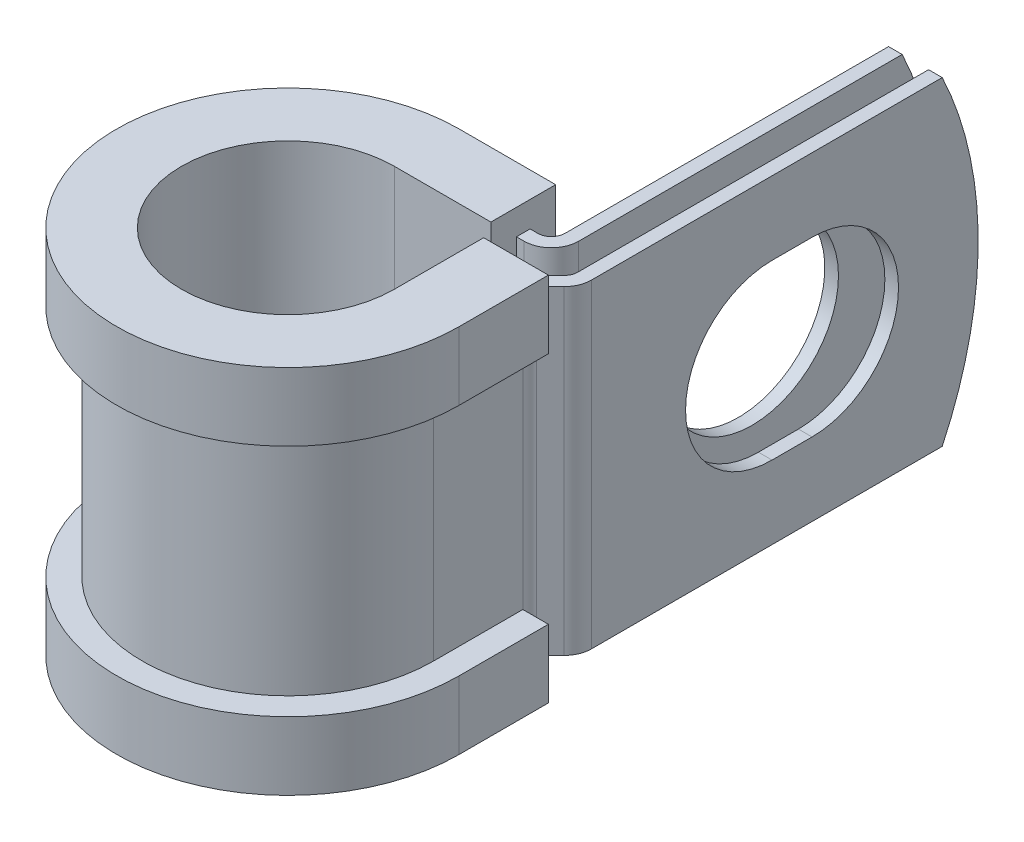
SolidWorks part; units mm, degrees
ref_plane "Front Plane" through (0, 0, 0) normal (0, 0, 1) x (1, 0, 0)
ref_plane "Top Plane" through (0, 0, 0) normal (0, 1, 0) x (1, 0, 0)
ref_plane "Right Plane" through (0, 0, 0) normal (1, 0, 0) x (0, 0, -1)
sketch "Sketch1" plane through (0, 0, 0) normal (0, 1, 0) x (1, 0, 0)
  line L0 (0, 7.874) -> (6.214, 7.874)
  line L1 (7.874, 0) -> (7.874, 5.3236)
  line L2 (7.8396, 30.9372) -> (7.8396, 9.4996)
  line L3 (8.3501, 6.4731) -> (9.1763, 7.2993)
  line L5 (9.4144, 7.874) -> (9.4144, 30.9372)
  arc A0 (0, 7.874) -> (7.874, 0) centre (0, 0) ccw
  arc A1 (8.3501, 6.4731) -> (7.874, 5.3236) centre (9.4996, 5.3236) ccw
  arc A2 (9.1763, 7.2993) -> (9.4144, 7.874) centre (8.6016, 7.874) ccw
  arc A3 (6.214, 7.874) -> (7.8396, 9.4996) centre (6.214, 9.4996) ccw
extrude "Extrude-Thin1" add sketch "Sketch1" along normal mid plane 19.05 thin
sketch "Sketch2" plane through (7.0268, 0, 0) normal (-1, 0, 0) x (0, 0, 1)
  line L0 (-30.9372, 9.525) -> (-30.9372, -9.525) construction
  line L1 (0, 9.525) -> (0, -9.525) construction
  circle A0 centre (-19.8374, 0) radius 5.1562
  point P2 (-30.9372, 0)
extrude "Cut-Extrude1" cut sketch "Sketch2" against normal up to surface (0.8128 mm away)
sketch "Sketch3" plane through (10.2272, 0, 0) normal (1, 0, 0) x (0, 0, -1)
  line L0 (18.6436, 0) -> (21.0312, 0) construction
  line L1 (18.6436, 5.1562) -> (21.0312, 5.1562)
  line L2 (18.6436, -5.1562) -> (21.0312, -5.1562)
  line L3 (30.9372, 9.525) -> (30.9372, -9.525) construction
  arc A0 (18.6436, 5.1562) -> (18.6436, -5.1562) centre (18.6436, 0) ccw
  arc A1 (21.0312, -5.1562) -> (21.0312, 5.1562) centre (21.0312, 0) ccw
  point P3 (19.8374, 0)
  point P8 (30.9372, 0)
  point P11 (13.4874, 0)
  point P12 (26.1874, 0)
extrude "Cut-Extrude2" cut sketch "Sketch3" against normal up to surface (0.8128 mm away)
sketch "Sketch4" plane through (7.0268, 0, 0) normal (-1, 0, 0) x (0, 0, 1)
  line L0 (-30.9372, 9.525) -> (-30.9372, -9.525)
  line L1 (-30.9372, 9.525) -> (-28.7927, 9.525)
  line L2 (-30.9372, 9.525) -> (-9.4996, 9.525) construction
  line L3 (-30.9372, -9.525) -> (-28.7927, -9.525)
  line L4 (-30.9372, -9.525) -> (-9.4996, -9.525) construction
  arc A0 (-28.7927, 9.525) -> (-28.7927, -9.525) centre (-8.7122, 0) ccw
extrude "Cut-Extrude3" cut sketch "Sketch4" against normal through all contours A0 M4 M5 | A0 L0 M2
ref_plane "Plane1" through (0, 0, -5.3236) normal (0, 0, -1) x (-1, 0, 0)
ref_plane "Plane2" through (5.7568, 0, 0) normal (-1, 0, 0) x (0, 0, 1)
sketch "Sketch5" plane through (0, 0, -5.3236) normal (0, 0, -1) x (-1, 0, 0)
  line L0 (-8.6868, 9.525) -> (-7.874, 9.525)
  line L1 (-8.6868, 9.525) -> (-8.6868, -9.525) construction
  line L3 (-7.874, 9.525) -> (-7.874, -9.525)
  line L4 (-7.874, -9.525) -> (-8.6868, -9.525)
  line L5 (-8.6868, -9.525) -> (-8.6868, -6.985)
  line L6 (-8.6868, 9.525) -> (-8.6868, 6.985)
  line L7 (-10.2108, 11.049) -> (-10.2108, 6.985)
  line L8 (-10.2108, 11.049) -> (-6.35, 11.049)
  line L9 (-6.35, 11.049) -> (-6.35, -11.049)
  line L10 (-6.35, -11.049) -> (-10.2108, -11.049)
  line L11 (-10.2108, -11.049) -> (-10.2108, -6.985)
  line L12 (-10.2108, 6.985) -> (-8.6868, 6.985)
  line L13 (-8.6868, -6.985) -> (-10.2108, -6.985)
sketch "Sketch6" plane through (0, 9.525, 0) normal (0, 1, 0) x (1, 0, 0)
  line L0 (6.35, 0) -> (6.35, 5.3236)
  line L1 (6.35, 5.3236) -> (10.2108, 5.3236) construction
  line L2 (5.7568, 6.9878) -> (5.7568, -6.9878) construction
  line L5 (0, 6.35) -> (5.7568, 6.35)
  arc A0 (0, 6.35) -> (6.35, 0) centre (0, 0) ccw
sweep "Sweep1" add profiles "Sketch5" path "Sketch6"
equation "\"D4@Sketch5\" = \"D1@Extrude-Thin1\""
equation "\"D5@Sketch5\" = \"D5@Extrude-Thin1\""
equation "\"D1@Sketch3\" = \"D2@Sketch2\""
equation "\"D7@Sketch1\" = \"D3@Sketch2\" + \"D1@Sketch3\""
equation "\"D1@Sketch1\" = \"D1@Sketch6\" + 2 * \"D3@Sketch5\""
equation "\"D1@Sketch4\" = ( \"D1@Extrude-Thin1\" + .125 ) * 2"
equation "\"D9@Sketch1\"= \"D5@Extrude-Thin1\""
equation "\"D8@Sketch1\"= 2 * \"D5@Extrude-Thin1\""
equation "\"D2@Sketch1\" = 2 * \"D5@Extrude-Thin1\""
equation "\"D2@Sketch3\" = \"D1@Sketch2\""
